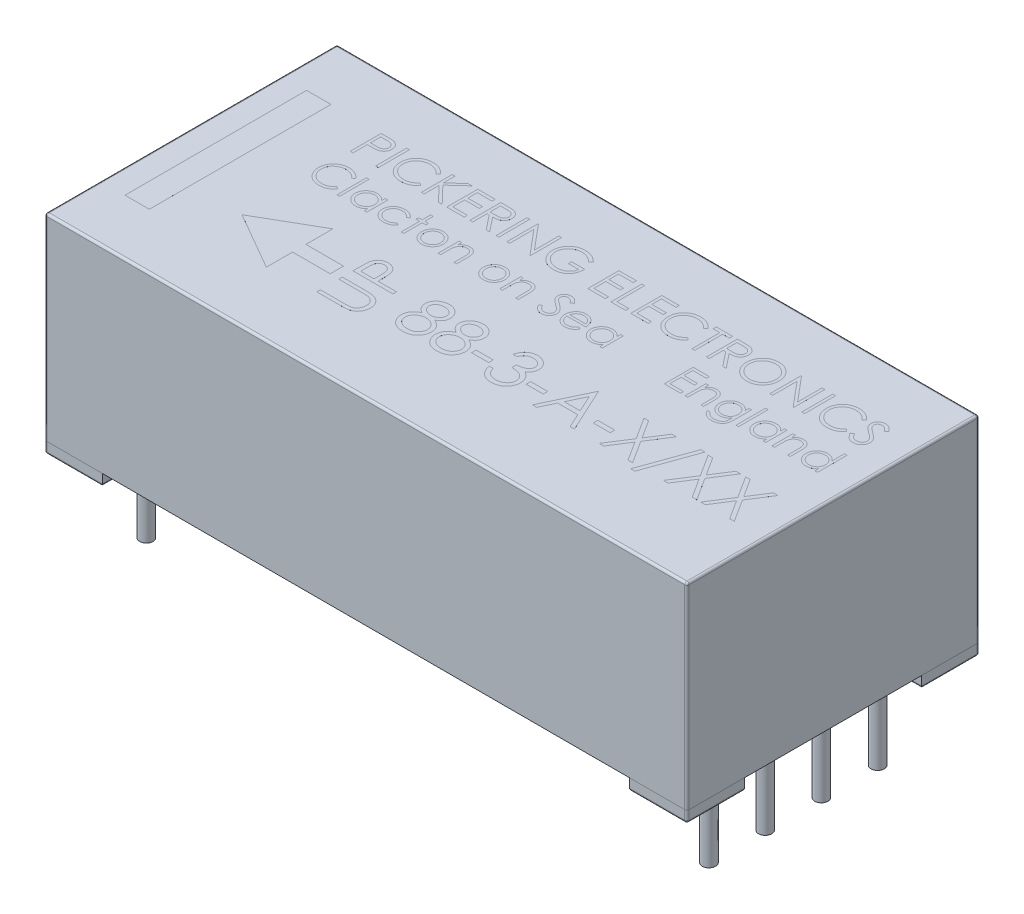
SolidWorks part; units mm, degrees
ref_plane "Front Plane" through (0, 0, 0) normal (0, 0, 1) x (1, 0, 0)
ref_plane "Top Plane" through (0, 0, 0) normal (0, 1, 0) x (1, 0, 0)
ref_plane "Right Plane" through (0, 0, 0) normal (1, 0, 0) x (0, 0, -1)
sketch "Sketch2" plane through (0, 0, 0) normal (0, 1, 0) x (1, 0, 0)
  line L1 (14.5, -6.6) -> (-14.5, -6.6)
  line L2 (14.5, -6.6) -> (14.5, 6.6)
  line L3 (14.5, 6.6) -> (-14.5, 6.6)
  line L4 (-14.5, -6.6) -> (-14.5, 6.6)
  line L5 (14.5, -6.6) -> (-14.5, 6.6) construction
  line L6 (14.5, 6.6) -> (-14.5, -6.6) construction
  point P0 (0, 0)
  dimension "D1" = 13.2
  dimension "D2" = 29
extrude "Main Body" add sketch "Sketch2" along normal blind 8.89 draft 0.023
sketch "Sketch9" plane through (0, 0, 0) normal (0, -1, 0) x (1, 0, 0)
  line L0 (14.5, -6.6) -> (-14.5, -6.6) construction
  line L1 (14.5, 6.6) -> (14.5, -6.6) construction
  circle A0 centre (12.7, -3.81) radius 0.3
  circle A1 centre (12.7, -1.27) radius 0.2963
  circle A2 centre (12.7, 1.27) radius 0.3
  circle A3 centre (12.7, 3.81) radius 0.3
  dimension "D1" = 0.6
  dimension "D5" = 0.6
  dimension "D7" = 0.6
  dimension "D2" = 2.79
  dimension "D3" = 2.54
  dimension "D4" = 1.8
  dimension "D6" = 2.54
  dimension "D8" = 2.54
extrude "Pins" add sketch "Sketch9" along normal blind 4.31
mirror "Mirror2" about plane through (0, 0, 0) normal (1, 0, 0) of "Pins"
sketch "Sketch10" plane through (0, 0, 0) normal (0, -1, 0) x (1, 0, 0)
  line L1 (14.5, 6.6) -> (11.9, 6.6)
  line L2 (14.5, 6.6) -> (14.5, 4)
  line L3 (14.5, 4) -> (11.9, 4)
  line L4 (11.9, 6.6) -> (11.9, 4)
  dimension "D1" = 2.6
  dimension "D2" = 2.6
extrude "Foot" add sketch "Sketch10" along normal blind 0.51
sketch "Sketch11" plane through (0, -0.51, 0) normal (0, -1, 0) x (1, 0, 0)
  line L0 (14.5, 6.6) -> (11.9, 6.6) construction
  line L1 (11.9, 4) -> (13.95, 4)
  line L2 (11.9, 4) -> (11.9, 6.05)
  line L3 (11.9, 6.05) -> (13.95, 6.05)
  line L4 (13.95, 4) -> (13.95, 6.05)
  line L5 (14.5, 4) -> (14.5, 6.6) construction
  dimension "D1" = 0.55
  dimension "D2" = 0.55
extrude "Extrude2" cut sketch "Sketch11" against normal up to surface (0.51 mm away)
mirror "Mirror3" about plane through (0, 0, 0) normal (0, 0, 1) of "Extrude2", "Foot"
mirror "Mirror4" about plane through (0, 0, 0) normal (1, 0, 0) of "Mirror3", "Foot", "Extrude2"
sketch "Sketch12"
  dimension "D1" = 1.1
  dimension "D2" = 8.2
  dimension "D3" = 2.4965
  dimension "D4" = 1.4
  dimension "D5" = 2
  dimension "D6" = 3.8
extrude "Lettering" add sketch "Sketch12" along normal blind 0.0001
fillet "Fillet1" radius 0.1 36 edges at (14.5, -0.255, -6.6) (-14.5, -0.255, -6.6) (14.5, -0.255, 6.6) (-14.5, -0.255, 6.6) (14.225, -0.51, -4) (14.5, -0.51, -5.3) (13.2, -0.51, -6.6) (11.9, -0.51, -6.325) (12.925, -0.51, -6.05) (13.95, -0.51, -5.025) (11.9, -0.51, 6.325) (13.2, -0.51, 6.6) (14.5, -0.51, 5.3) (14.225, -0.51, 4) (13.95, -0.51, 5.025) (12.925, -0.51, 6.05) (-11.9, -0.51, -6.325) (-13.2, -0.51, -6.6) (-14.5, -0.51, -5.3) (-14.225, -0.51, -4) (-13.95, -0.51, -5.025) (-12.925, -0.51, -6.05) (-14.225, -0.51, 4) (-14.5, -0.51, 5.3) (-13.2, -0.51, 6.6) (-11.9, -0.51, 6.325) (-12.925, -0.51, 6.05) (-13.95, -0.51, 5.025) (14.4983, 4.445, -6.5983) (-14.4983, 4.445, -6.5983) (-14.4965, 8.89, 0) (0, 8.89, -6.5965) (14.4965, 8.89, 0) (14.4983, 4.445, 6.5983) (-14.4983, 4.445, 6.5983) (0, 8.89, 6.5965)
sketch "Sketch13"
  line L0 (12.2755, 4.1) -> (12.2755, -4.1) construction
sketch_block_instance "UP-1"
sketch_block "UP"
sketch_block_instance "Block1-1"
sketch_block "Block1" parameters "D1"=1.7, "D2"=2.2, "D3"=2.6, "D4"=1.24
extrude "Arrow" add sketch "Sketch13" along normal blind 0.0001
